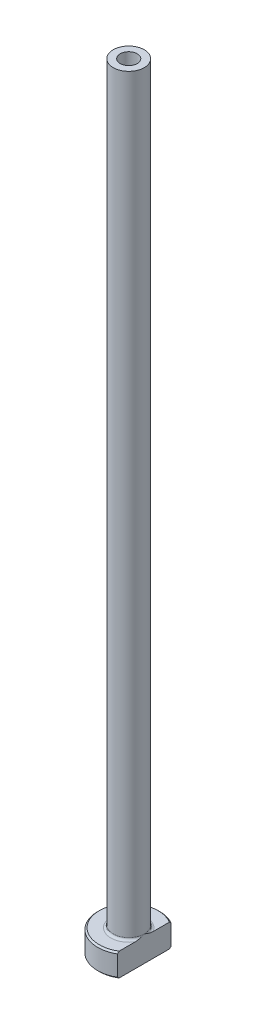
SolidWorks part; units mm, degrees
ref_plane "Front Plane" through (0, 0, 0) normal (0, 0, 1) x (1, 0, 0)
ref_plane "Top Plane" through (0, 0, 0) normal (0, 1, 0) x (1, 0, 0)
ref_plane "Right Plane" through (0, 0, 0) normal (1, 0, 0) x (0, 0, -1)
sketch "Sketch1" plane through (0, 0, 0) normal (0, 0, 1) x (1, 0, 0)
  line L0 (-1.1, 100) -> (-2, 100)
  line L1 (-2, 100) -> (-2, 3)
  line L2 (-2, 3) -> (-4, 3)
  line L3 (-4, 3) -> (-4, 0)
  line L4 (2.475, 0) -> (-2.475, 0) construction
  line L5 (-4, 0) -> (-1.35, 0)
  line L6 (-1.1, 65) -> (-1.1, 100)
  line L7 (0, 92.1877) -> (0, -15.5353) construction
  line L8 (0, -3.3) -> (0, 3.3) construction
  line L9 (-1.1, 65) -> (-1.35, 53)
  line L10 (-1.35, 53) -> (-1.35, 0)
  dimension "D1" = 0.25
  dimension "ID" = 2.2
  dimension "OD" = 4
  dimension "L" = 100
  dimension "H" = 8
  dimension "T" = 3
  dimension "N" = 35
  dimension "D2" = 12
  dimension "L-N" = 65
revolve "Revolve1" add sketch "Sketch1" angle 360 about L7
fillet "Fillet1" radius 0.3 1 edges at (0, 3, 2)
chamfer "Chamfer1" distance 0.2 angle 45 2 edges at (0, 3, 4) (0, 0, 4)
sketch "Sketch2" plane through (0, 0, 0) normal (0, -1, 0) x (1, 0, 0)
  line L0 (2, 3.4641) -> (2, -3.4641)
  circle A0 centre (0, 0) radius 4 construction
  arc A1 (2, 3.4641) -> (2, -3.4641) centre (0, 0) cw
  circle A2 centre (0, 0) radius 2 construction
extrude "Cut-Extrude1" cut sketch "Sketch2" against normal through all
chamfer "Chamfer2" distance 0.5 angle 45 1 edges at (0, 0, 1.35)
